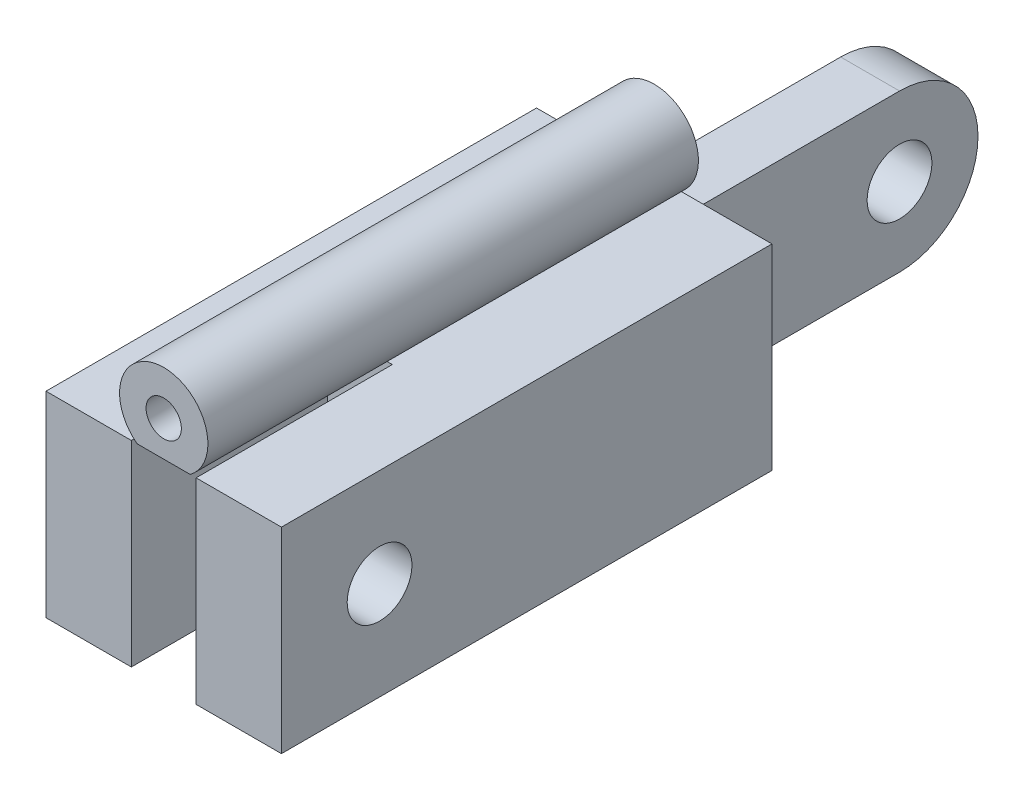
SolidWorks part; units mm, degrees
ref_plane "Front Plane" through (0, 0, 0) normal (0, 0, 1) x (1, 0, 0)
ref_plane "Top Plane" through (0, 0, 0) normal (0, 1, 0) x (1, 0, 0)
ref_plane "Right Plane" through (0, 0, 0) normal (1, 0, 0) x (0, 0, -1)
sketch "Sketch1" plane through (0, 0, 0) normal (0, 1, 0) x (1, 0, 0)
  line L0 (7.65, 0) -> (12, 0)
  line L1 (0, 0) -> (4.35, 0)
  line L2 (0, 0) -> (0, 25)
  line L3 (4.5, 40) -> (7.5, 40)
  line L4 (12, 0) -> (12, 25)
  line L6 (4.35, 0) -> (4.35, 10)
  line L7 (4.35, 10) -> (7.65, 10)
  line L8 (7.65, 0) -> (7.65, 10)
  line L11 (0, 25) -> (4.5, 25)
  line L12 (4.5, 40) -> (4.5, 25)
  line L15 (12, 25) -> (7.5, 25)
  line L16 (7.5, 40) -> (7.5, 25)
  dimension "D1" = 12
  dimension "D3" = 4.5
  dimension "D4" = 4.5
  dimension "D5" = 15
  dimension "D6" = 15
  dimension "D7" = 3.3
  dimension "D8" = 4.35
extrude "Boss-Extrude1" add sketch "Sketch1" along normal blind 10
sketch "Sketch2" plane through (0, 10, 0) normal (0, 1, 0) x (1, 0, 0)
  line L1 (4.5, 40) -> (7.5, 40)
  line L2 (4.5, 40) -> (4.5, 25)
  line L3 (4.5, 25) -> (7.5, 25)
  line L4 (7.5, 40) -> (7.5, 25)
extrude "Cut-Extrude1" cut sketch "Sketch2" against normal blind 1
sketch "Sketch3" plane through (0, 0, 0) normal (0, -1, 0) x (1, 0, 0)
  line L1 (4.5, -25) -> (7.5, -25)
  line L2 (4.5, -25) -> (4.5, -40)
  line L3 (4.5, -40) -> (7.5, -40)
  line L4 (7.5, -25) -> (7.5, -40)
extrude "Cut-Extrude2" cut sketch "Sketch3" against normal blind 1
sketch "Sketch5" plane through (4.5, 0, 0) normal (-1, 0, 0) x (0, 0, 1)
  line L0 (-40, 9) -> (-40, 1) construction
  line L1 (-40, 9) -> (-25, 9) construction
  circle A0 centre (-36, 5) radius 1.65
  dimension "D1" = 3.3
  dimension "D2" = 4
  dimension "D3" = 4
extrude "Cut-Extrude3" cut sketch "Sketch5" against normal blind 10
fillet "Fillet1" radius 4 2 edges at (6, 9, -40) (6, 1, -40)
sketch "Sketch6" plane through (0, 0, 0) normal (-1, 0, 0) x (0, 0, 1)
  line L0 (0, 10) -> (0, 0) construction
  line L1 (-25, 0) -> (0, 0) construction
  circle A0 centre (-5, 5) radius 1.65
  dimension "D1" = 3.3
  dimension "D2" = 5
  dimension "D3" = 5
extrude "Cut-Extrude4" cut sketch "Sketch6" against normal through all
sketch "Sketch7" plane through (0, 0, -10) normal (0, 0, 1) x (1, 0, 0)
  line L1 (7.65, 0) -> (4.35, 0)
  line L2 (7.65, 0) -> (7.65, 0.5)
  line L3 (7.65, 0.5) -> (4.35, 0.5)
  line L4 (4.35, 0) -> (4.35, 0.5)
  dimension "D1" = 3.3
  dimension "D2" = 0.5
sketch "Sketch8" plane through (0, 0, -25) normal (0, 0, -1) x (-1, 0, 0)
  line L0 (-7.65, 0) -> (-4.35, 0) construction
  line L1 (0, 10) -> (0, 0) construction
  line L2 (-7.35, 0) -> (-4.65, 0)
  arc A0 (-7.35, 0) -> (-4.65, 0) centre (-6, -1.8) ccw
  dimension "D1" = 4.5
  dimension "D2" = 1.8
  dimension "D3" = 6
extrude "Boss-Extrude2" add sketch "Sketch8" against normal blind 15
sketch "Sketch9" plane through (0, 0, -25) normal (0, 0, -1) x (-1, 0, 0)
  line L0 (-12, 10) -> (-12, 0) construction
  line L1 (-12, 10) -> (0, 10) construction
  line L2 (-7.35, 10) -> (-4.65, 10)
  arc A0 (-4.65, 10) -> (-7.35, 10) centre (-6, 11.8) ccw
  dimension "D2" = 4.5
  dimension "D1" = 6
  dimension "D3" = 1.8
extrude "Boss-Extrude3" add sketch "Sketch9" against normal blind 25
sketch "Sketch10" plane through (0, 0, -25) normal (0, 0, -1) x (-1, 0, 0)
  circle A0 centre (-6, 11.8) radius 0.9
  circle A1 centre (-6, -1.8) radius 0.9
  arc A2 (-7.35, 0) -> (-4.65, 0) centre (-6, -1.8) ccw construction
  arc A3 (-4.65, 10) -> (-7.35, 10) centre (-6, 11.8) ccw construction
  dimension "D1" = 1.8
  dimension "D4" = 1.8
  dimension "D2" = 0
  dimension "D3" = 0
extrude "Cut-Extrude5" cut sketch "Sketch10" against normal blind 25
